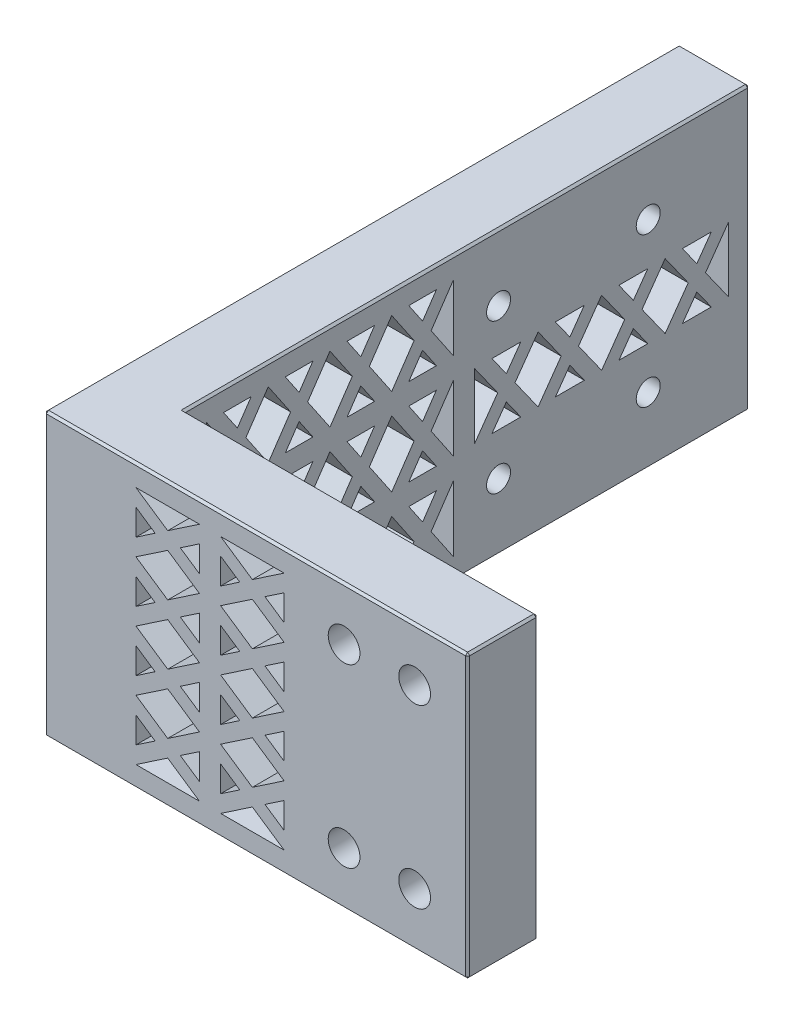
SolidWorks part; units mm, degrees
ref_plane "前视基准面" through (0, 0, 0) normal (0, 0, 1) x (1, 0, 0)
ref_plane "上视基准面" through (0, 0, 0) normal (0, 1, 0) x (1, 0, 0)
ref_plane "右视基准面" through (0, 0, 0) normal (1, 0, 0) x (0, 0, -1)
other "Configuration Table"
sketch "草图1" plane through (0, 0, 0) normal (0, 1, 0) x (1, 0, 0)
  line L5 (5, -40) -> (-5, -40)
  line L6 (5, -40) -> (5, 40)
  line L7 (5, 40) -> (-5, 40)
  line L8 (-5, -40) -> (-5, 40)
  line L9 (5, -40) -> (-5, 40) construction
  line L10 (5, 40) -> (-5, -40) construction
  point P0 (0, 0)
  dimension "D1" = 10
  dimension "D2" = 80
extrude "凸台-拉伸1" add sketch "草图1" along normal mid plane 40
sketch "草图2" plane through (0, 0, 40) normal (0, 0, 1) x (1, 0, 0)
  line L0 (-5, 20) -> (5, 20) construction
  line L1 (55, -20) -> (-55, -20)
  line L2 (55, -20) -> (55, 20)
  line L3 (55, 20) -> (-55, 20)
  line L4 (-55, -20) -> (-55, 20)
  line L5 (55, -20) -> (-55, 20) construction
  line L6 (55, 20) -> (-55, -20) construction
  point P0 (0, 0)
  dimension "D1" = 110
extrude "凸台-拉伸2" add sketch "草图2" along normal blind 10
hole_wizard "M3 六角圆柱头螺钉的柱形沉头孔1" positions "草图3" profile "草图4" counterbore size "M3" standard "GB"
sketch "草图3" plane through (-5, 0, 0) normal (-1, 0, 0) x (0, 0, 1)
  line L0 (-40, 20) -> (-40, -20) construction
  line L2 (-4.3934, -10.6066) -> (-25.6066, -10.6066)
  line L3 (-4.3934, -10.6066) -> (-4.3934, 10.6066)
  line L4 (-4.3934, 10.6066) -> (-25.6066, 10.6066)
  line L5 (-25.6066, -10.6066) -> (-25.6066, 10.6066)
  line L6 (-4.3934, -10.6066) -> (-25.6066, 10.6066) construction
  line L7 (-4.3934, 10.6066) -> (-25.6066, -10.6066) construction
  circle A0 centre (-15, 0) radius 15 construction
  dimension "D2" = 30
  dimension "D1" = 25
sketch "草图4" plane through (-5, -10.6066, -25.6066) normal (0, 1, 0) x (0, 0, 1)
  line L0 (0, 0) -> (0, 10)
  line L1 (0, 10) -> (1.7, 10)
  line L3 (1.7, 10) -> (1.7, 4)
  line L4 (3, 4) -> (1.7, 4)
  line L5 (3, 4) -> (3, 0.025)
  line L6 (3, 0.025) -> (3.025, 0)
  line L7 (3.025, 0) -> (0, 0)
  line L8 (-3, 0.025) -> (-3.025, 0) construction
  line L11 (0, -6.35) -> (0, 107.95) construction
  dimension "通孔孔直径" = 3.4
  dimension "通孔孔深度" = 10
  dimension "柱形沉头孔直径" = 6
  dimension "柱形沉头孔深度" = 4
  dimension "近端锥形沉头孔直径" = 6.05
  dimension "近端锥形沉头孔角度" = 90
hole_wizard "M4 六角圆柱头螺钉的柱形沉头孔1" positions "草图5" profile "草图6" counterbore size "M4" standard "GB"
sketch "草图5" plane through (0, 0, 40) normal (0, 0, -1) x (-1, 0, 0)
  line L1 (47.5, -12.5) -> (-47.5, -12.5)
  line L2 (47.5, -12.5) -> (47.5, 12.5)
  line L3 (47.5, 12.5) -> (-47.5, 12.5)
  line L4 (-47.5, -12.5) -> (-47.5, 12.5)
  line L5 (47.5, -12.5) -> (-47.5, 12.5) construction
  line L6 (47.5, 12.5) -> (-47.5, -12.5) construction
  point P5 (0, 0)
  point P110 (-37.5, 12.5)
  point P112 (-37.5, -12.5)
  dimension "D1" = 25
  dimension "D2" = 95
  dimension "D3" = 10
sketch "草图6" plane through (37.5, -12.5, 40) normal (1, 0, 0) x (0, 1, 0)
  line L0 (0, 0) -> (0, 10)
  line L1 (0, 10) -> (2.25, 10)
  line L3 (2.25, 10) -> (2.25, 6)
  line L4 (4, 6) -> (2.25, 6)
  line L5 (4, 6) -> (4, 0.025)
  line L6 (4, 0.025) -> (4.025, 0)
  line L7 (4.025, 0) -> (0, 0)
  line L8 (-4, 0.025) -> (-4.025, 0) construction
  line L11 (0, -6.35) -> (0, 107.95) construction
  dimension "通孔孔直径" = 4.5
  dimension "通孔孔深度" = 10
  dimension "柱形沉头孔直径" = 8
  dimension "柱形沉头孔深度" = 6
  dimension "近端锥形沉头孔直径" = 8.05
  dimension "近端锥形沉头孔角度" = 90
sketch "草图7" plane through (0, 0, 40) normal (0, 0, -1) x (-1, 0, 0)
  line L4 (55, 20) -> (5, 20)
  line L5 (5, 20) -> (5, -20)
  line L6 (5, -20) -> (55, -20)
  line L7 (55, -20) -> (55, 20)
  line L8 (55, 20) -> (5, 20)
  line L9 (5, 20) -> (5, -20)
  line L10 (5, -20) -> (55, -20)
  line L11 (55, -20) -> (55, 20)
  dimension "D1" = 0
extrude "切除-拉伸1" cut sketch "草图7" against normal through all
chamfer "倒角1" distance 0.3 angle 45 17 edges at (55, 0, 50) (55, 0, 40) (5, 20, 0) (30, 20, 40) (55, 20, 45) (25, 20, 50) (-5, 20, 5) (5, 0, -40) (0, 20, -40) (-5, 0, -40) (55, -20, 45) (30, -20, 40) (5, -20, 0) (0, -20, -40) (-5, -20, 5) (25, -20, 50) (-5, 0, 50)
sketch "草图8" plane through (5, 0, 0) normal (1, 0, 0) x (0, 0, -1)
  line L0 (-40.3, 20) -> (39.7, 20) construction
  line L1 (-2, -17) -> (-37, -17)
  line L2 (-2, -17) -> (-2, 17)
  line L3 (-2, 17) -> (-37, 17)
  line L4 (-37, -17) -> (-37, 17)
  line L5 (-2, -17) -> (-37, 17) construction
  line L6 (-2, 17) -> (-37, -17) construction
  line L7 (-40, 19.7) -> (-40, -19.7) construction
  point P0 (-19.5, 0)
  point P5 (0, 0)
  dimension "D1" = 3
  dimension "D2" = 3
  dimension "D3" = 2
extrude "切除-拉伸2" cut sketch "草图8" against normal up to next
sketch "草图9" plane through (-5, 0, 0) normal (-1, 0, 0) x (0, 0, 1)
  line L0 (2, 17) -> (2, -17) construction
  line L1 (2, 7.6667) -> (37, 7.6667)
  line L2 (2, 7.6667) -> (2, 4.6667)
  line L3 (2, 4.6667) -> (37, 4.6667)
  line L4 (37, 7.6667) -> (37, 4.6667)
  line L5 (37, -17) -> (37, 17) construction
  line L6 (37, 17) -> (2, 17) construction
  line L7 (2, -4.6667) -> (37, -4.6667)
  line L8 (2, -4.6667) -> (2, -7.6667)
  line L9 (2, -7.6667) -> (37, -7.6667)
  line L10 (37, -4.6667) -> (37, -7.6667)
  dimension "D1" = 3
  dimension "D2" = 3
  dimension "D3" = 9.3333
  dimension "D4" = 9.3333
extrude "凸台-拉伸3" add sketch "草图9" against normal up to surface (10 mm away)
sketch "草图10" plane through (-5, 0, 0) normal (-1, 0, 0) x (0, 0, 1)
  line L0 (2, -4.6667) -> (4.417, -4.6667)
  line L1 (37, -4.6667) -> (2, -4.6667) construction
  line L2 (4.417, -4.6667) -> (10.75, 4.6667)
  line L3 (2, 4.6667) -> (37, 4.6667) construction
  line L4 (10.75, 4.6667) -> (8.333, 4.6667)
  line L5 (8.333, 4.6667) -> (2, -4.6667)
  line L6 (2, 4.6667) -> (4.417, 4.6667)
  line L7 (4.417, 4.6667) -> (10.75, -4.6667)
  line L8 (10.75, -4.6667) -> (8.333, -4.6667)
  line L9 (8.333, -4.6667) -> (2, 4.6667)
  line L10 (10.75, -4.6667) -> (13.167, -4.6667)
  line L11 (13.167, -4.6667) -> (19.5, 4.6667)
  line L12 (19.5, 4.6667) -> (17.083, 4.6667)
  line L13 (17.083, 4.6667) -> (10.75, -4.6667)
  line L14 (10.75, 4.6667) -> (13.167, 4.6667)
  line L15 (13.167, 4.6667) -> (19.5, -4.6667)
  line L16 (19.5, -4.6667) -> (17.083, -4.6667)
  line L17 (17.083, -4.6667) -> (10.75, 4.6667)
  line L18 (19.5, -4.6667) -> (21.917, -4.6667)
  line L19 (21.917, -4.6667) -> (28.25, 4.6667)
  line L20 (28.25, 4.6667) -> (25.833, 4.6667)
  line L21 (25.833, 4.6667) -> (19.5, -4.6667)
  line L22 (19.5, 4.6667) -> (21.917, 4.6667)
  line L23 (21.917, 4.6667) -> (28.25, -4.6667)
  line L24 (28.25, -4.6667) -> (25.833, -4.6667)
  line L25 (25.833, -4.6667) -> (19.5, 4.6667)
  line L26 (28.25, -4.6667) -> (30.667, -4.6667)
  line L27 (30.667, -4.6667) -> (37, 4.6667)
  line L28 (37, 4.6667) -> (34.583, 4.6667)
  line L29 (34.583, 4.6667) -> (28.25, -4.6667)
  line L30 (28.25, 4.6667) -> (30.667, 4.6667)
  line L31 (30.667, 4.6667) -> (37, -4.6667)
  line L32 (37, -4.6667) -> (34.583, -4.6667)
  line L33 (34.583, -4.6667) -> (28.25, 4.6667)
  line L34 (37, -4.6667) -> (37, 4.6667) construction
  point P12 (10.2245, 4.6667)
  point P15 (37, 4.6667)
  dimension "D1" = 2
  dimension "D2" = 2
  dimension "D3" = 4
extrude "凸台-拉伸4" add sketch "草图10" against normal up to surface (10 mm away) contours L2 L9 L5 M6 | L9 L2 L7 L5 | L9 L5 L7 M8 | L5 L7 L2 M8 | L9 L7 L2 M6 | L11 L17 L13 M6 | L17 L11 L15 L13 | L17 L13 L15 M8 | L13 L15 L11 M8 | L17 L15 L11 M6 | L25 L21 L23 M8 | L25 L19 L23 L21 | L19 L25 L21 M6 | L25 L23 L19 M6 | L21 L23 L19 M8 | L27 L33 L29 M6 | L33 L27 L31 L29 | L33 L29 L31 M8 | L29 L31 L27 M8 | L33 L31 L27 M6
pattern_linear "阵列(线性)1" count 2 spacing 12.3333 along (0, 1, 0) count 2 spacing 12.3333 along (0, -1, 0) of "凸台-拉伸4"
sketch "草图11" plane through (-5, 0, 0) normal (-1, 0, 0) x (0, 0, 1)
  line L0 (2, 4.6667) -> (2, -4.6667) construction
  line L1 (-1, -4.6066) -> (-37, -4.6066)
  line L2 (-1, -4.6066) -> (-1, 4.6066)
  line L3 (-1, 4.6066) -> (-37, 4.6066)
  line L4 (-37, -4.6066) -> (-37, 4.6066)
  line L5 (-1, -4.6066) -> (-37, 4.6066) construction
  line L6 (-1, 4.6066) -> (-37, -4.6066) construction
  line L7 (-40, -19.7) -> (-40, 19.7) construction
  circle A2 centre (-25.6066, 10.6066) radius 3 construction
  point P0 (-19, 0)
  point P5 (0, 0)
  point P9 (-17.0752, 0)
  dimension "D3" = 3
  dimension "D1" = 3
  dimension "D2" = 3
extrude "切除-拉伸3" cut sketch "草图11" against normal up to next
sketch "草图12" plane through (-5, 0, 0) normal (-1, 0, 0) x (0, 0, 1)
  line L0 (-37, -4.6066) -> (-34.5465, -4.6066)
  line L1 (-37, -4.6066) -> (-1, -4.6066) construction
  line L2 (-34.5465, -4.6066) -> (-28, 4.6066)
  line L3 (-1, 4.6066) -> (-37, 4.6066) construction
  line L4 (-28, 4.6066) -> (-30.4535, 4.6066)
  line L5 (-30.4535, 4.6066) -> (-37, -4.6066)
  line L6 (-37, 4.6066) -> (-34.5465, 4.6066)
  line L7 (-34.5465, 4.6066) -> (-28, -4.6066)
  line L8 (-28, -4.6066) -> (-30.4535, -4.6066)
  line L9 (-30.4535, -4.6066) -> (-37, 4.6066)
  line L10 (-28, -4.6066) -> (-25.5465, -4.6066)
  line L11 (-25.5465, -4.6066) -> (-19, 4.6066)
  line L12 (-19, 4.6066) -> (-21.4535, 4.6066)
  line L13 (-21.4535, 4.6066) -> (-28, -4.6066)
  line L14 (-28, 4.6066) -> (-25.5465, 4.6066)
  line L15 (-25.5465, 4.6066) -> (-19, -4.6066)
  line L16 (-19, -4.6066) -> (-21.4535, -4.6066)
  line L17 (-21.4535, -4.6066) -> (-28, 4.6066)
  line L18 (-19, -4.6066) -> (-16.5465, -4.6066)
  line L19 (-16.5465, -4.6066) -> (-10, 4.6066)
  line L20 (-10, 4.6066) -> (-12.4535, 4.6066)
  line L21 (-12.4535, 4.6066) -> (-19, -4.6066)
  line L22 (-19, 4.6066) -> (-16.5465, 4.6066)
  line L23 (-16.5465, 4.6066) -> (-10, -4.6066)
  line L24 (-10, -4.6066) -> (-12.4535, -4.6066)
  line L25 (-12.4535, -4.6066) -> (-19, 4.6066)
  line L26 (-10, -4.6066) -> (-7.5465, -4.6066)
  line L27 (-7.5465, -4.6066) -> (-1, 4.6066)
  line L28 (-1, 4.6066) -> (-3.4535, 4.6066)
  line L29 (-3.4535, 4.6066) -> (-10, -4.6066)
  line L30 (-10, 4.6066) -> (-7.5465, 4.6066)
  line L31 (-7.5465, 4.6066) -> (-1, -4.6066)
  line L32 (-1, -4.6066) -> (-3.4535, -4.6066)
  line L33 (-3.4535, -4.6066) -> (-10, 4.6066)
  line L34 (-1, -4.6066) -> (-1, 4.6066) construction
  point P15 (-28.8777, 4.6066)
  point P17 (-1, 4.6066)
  dimension "D1" = 2
  dimension "D2" = 2
  dimension "D3" = 4
extrude "凸台-拉伸5" add sketch "草图12" against normal up to surface (10 mm away) contours L2 L9 L5 L0 | L9 L2 L7 L5 | L9 L5 L7 L6 | L5 L7 L2 L4 | L9 L8 L7 L2 | L11 L17 L13 L10 | L17 L11 L15 L13 | L17 L13 L15 L14 | L13 L15 L11 L12 | L17 L16 L15 L11 | L19 L25 L21 L18 | L25 L19 L23 L21 | L25 L21 L23 L22 | L21 L23 L19 L20 | L25 L24 L23 L19 | L27 L33 L29 L26 | L33 L27 L31 L29 | L33 L29 L31 L30 | L29 L31 L27 L28 | L33 L32 L31 L27
sketch "草图13" plane through (0, 0, 40) normal (0, 0, -1) x (-1, 0, 0)
  line L0 (-5, 19.7) -> (-5, -19.7) construction
  line L1 (-8, -17) -> (-29, -17)
  line L2 (-8, -17) -> (-8, 17)
  line L3 (-8, 17) -> (-29, 17)
  line L4 (-29, -17) -> (-29, 17)
  line L5 (-8, -17) -> (-29, 17) construction
  line L6 (-8, 17) -> (-29, -17) construction
  line L7 (-54.7, 20) -> (-4.7, 20) construction
  point P0 (-18.5, 0)
  point P5 (0, 0)
  dimension "D1" = 3
  dimension "D2" = 3
  dimension "D3" = 21
extrude "切除-拉伸4" cut sketch "草图13" against normal up to next
sketch "草图14" plane through (0, 0, 40) normal (0, 0, -1) x (-1, 0, 0)
  line L0 (-8, 17) -> (-29, 17) construction
  line L1 (-17, -17) -> (-20, -17)
  line L2 (-17, -17) -> (-17, 17)
  line L3 (-17, 17) -> (-20, 17)
  line L4 (-20, -17) -> (-20, 17)
  line L5 (-17, -17) -> (-20, 17) construction
  line L6 (-17, 17) -> (-20, -17) construction
  line L7 (-29, -17) -> (-8, -17) construction
  line L8 (-18.5, 0) -> (-18.5, -17) construction
  point P0 (-18.5, 0)
  point P7 (-23.8771, -17)
  point P12 (-18.5, -17)
  dimension "D1" = 3
extrude "凸台-拉伸6" add sketch "草图14" against normal up to surface (10 mm away)
sketch "草图15" plane through (0, 0, 40) normal (0, 0, -1) x (-1, 0, 0)
  line L0 (-29, 17) -> (-29, 14.5857)
  line L1 (-29, 17) -> (-29, -17) construction
  line L2 (-29, 14.5857) -> (-20, 8.5)
  line L3 (-20, 17) -> (-20, -17) construction
  line L4 (-20, 8.5) -> (-20, 10.9143)
  line L5 (-20, 10.9143) -> (-29, 17)
  line L6 (-20, 17) -> (-20, 14.5857)
  line L7 (-20, 14.5857) -> (-29, 8.5)
  line L8 (-29, 8.5) -> (-29, 10.9143)
  line L9 (-29, 10.9143) -> (-20, 17)
  line L10 (-29, 8.5) -> (-29, 6.0857)
  line L11 (-29, 6.0857) -> (-20, 0)
  line L12 (-20, 0) -> (-20, 2.4143)
  line L13 (-20, 2.4143) -> (-29, 8.5)
  line L14 (-20, 8.5) -> (-20, 6.0857)
  line L15 (-20, 6.0857) -> (-29, 0)
  line L16 (-29, 0) -> (-29, 2.4143)
  line L17 (-29, 2.4143) -> (-20, 8.5)
  line L18 (-29, 0) -> (-29, -2.4143)
  line L19 (-29, -2.4143) -> (-20, -8.5)
  line L20 (-20, -8.5) -> (-20, -6.0857)
  line L21 (-20, -6.0857) -> (-29, 0)
  line L22 (-20, 0) -> (-20, -2.4143)
  line L23 (-20, -2.4143) -> (-29, -8.5)
  line L24 (-29, -8.5) -> (-29, -6.0857)
  line L25 (-29, -6.0857) -> (-20, 0)
  line L26 (-29, -8.5) -> (-29, -10.9143)
  line L27 (-29, -10.9143) -> (-20, -17)
  line L28 (-20, -17) -> (-20, -14.5857)
  line L29 (-20, -14.5857) -> (-29, -8.5)
  line L30 (-20, -8.5) -> (-20, -10.9143)
  line L31 (-20, -10.9143) -> (-29, -17)
  line L32 (-29, -17) -> (-29, -14.5857)
  line L33 (-29, -14.5857) -> (-20, -8.5)
  line L34 (-29, -17) -> (-20, -17) construction
  point P12 (0, 0)
  point P15 (-20, -17)
  dimension "D1" = 2
  dimension "D2" = 2
  dimension "D3" = 4
extrude "凸台-拉伸7" add sketch "草图15" against normal up to surface (10 mm away) contours L2 L9 L5 M8 | L9 L2 L7 L5 | L9 L5 L7 M6 | L5 L7 L2 M6 | L9 L7 L2 M8 | L11 L17 L13 M8 | L17 L13 L15 M6 | L17 L11 L15 L13 | L17 L15 L11 M8 | L13 L15 L11 M6 | L25 L21 L23 M6 | L25 L19 L23 L21 | L19 L25 L21 M8 | L25 L23 L19 M8 | L21 L23 L19 M6 | L27 L33 L29 M8 | L33 L27 L31 L29 | L33 L29 L31 M6 | L29 L31 L27 M6 | L33 L31 L27 M8
pattern_linear "阵列(线性)2" count 2 spacing 12 along (-1, 0, 0) of "凸台-拉伸7"
